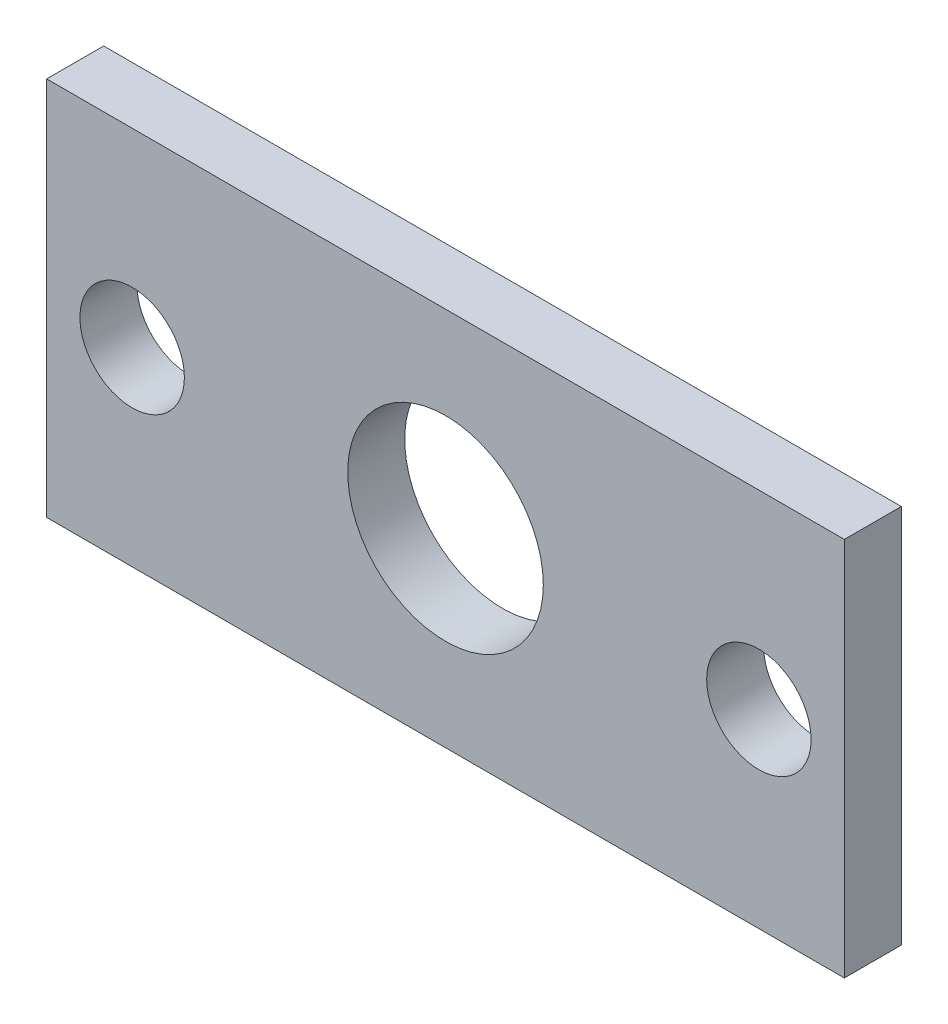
SolidWorks part; units mm, degrees
ref_plane "前视基准面" through (0, 0, 0) normal (0, 0, 1) x (1, 0, 0)
ref_plane "上视基准面" through (0, 0, 0) normal (0, 1, 0) x (1, 0, 0)
ref_plane "右视基准面" through (0, 0, 0) normal (1, 0, 0) x (0, 0, -1)
sketch "草图1" plane through (0, 0, 0) normal (0, 0, 1) x (1, 0, 0)
  line L1 (-6.8755, 12.5582) -> (35.1245, 12.5582)
  line L2 (-6.8755, 12.5582) -> (-6.8755, -7.4418)
  line L3 (-6.8755, -7.4418) -> (35.1245, -7.4418)
  line L4 (35.1245, 12.5582) -> (35.1245, -7.4418)
  dimension "D1" = 42
  dimension "D2" = 20
extrude "凸台-拉伸1" add sketch "草图1" along normal blind 3
sketch "草图2" plane through (0, 0, 3) normal (0, 0, 1) x (1, 0, 0)
  line L0 (-6.8755, 12.5582) -> (-6.8755, -7.4418) construction
  line L1 (14.1245, 12.5582) -> (14.1245, -7.4418) construction
  line L2 (35.1245, 12.5582) -> (-6.8755, 12.5582) construction
  line L3 (-6.8755, -7.4418) -> (35.1245, -7.4418) construction
  circle A0 centre (-2.3755, 2.5582) radius 2.75
  circle A1 centre (30.6245, 2.5582) radius 2.75
  circle A2 centre (14.1245, 2.5582) radius 5.15
  dimension "D1" = 4.5
  dimension "D2" = 10.3
extrude "切除-拉伸1" cut sketch "草图2" against normal blind 3
